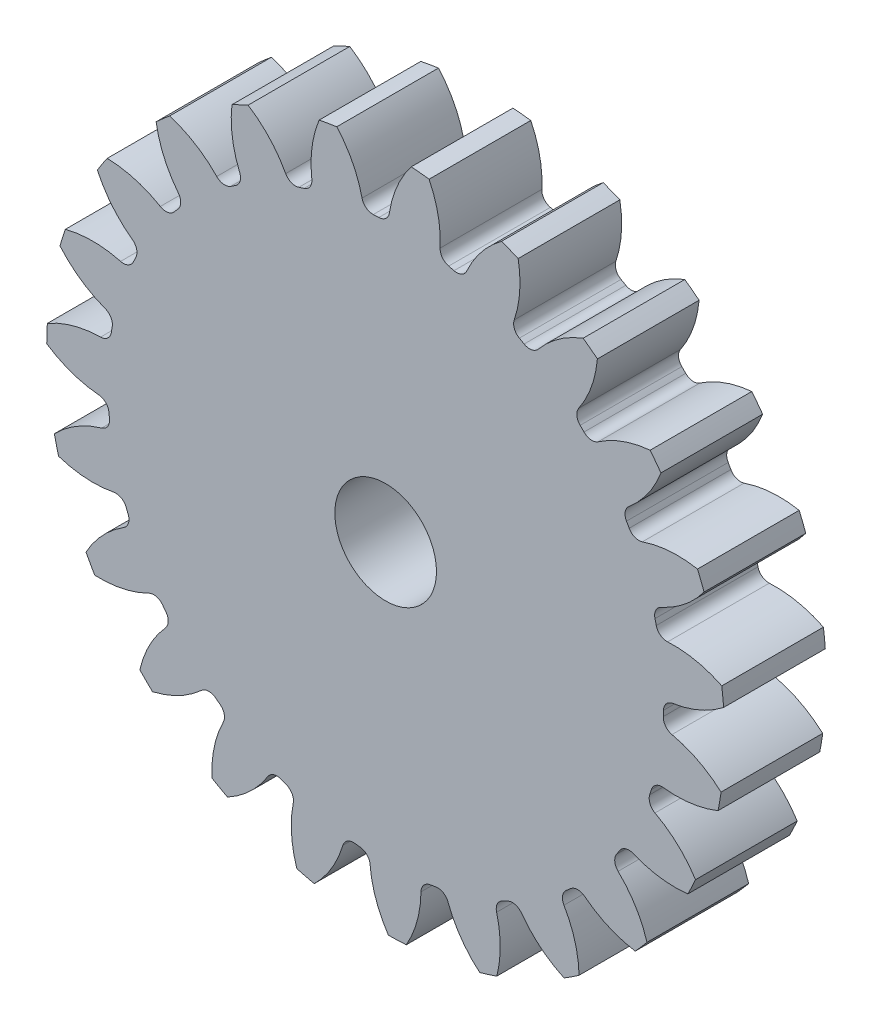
SolidWorks part; units mm, degrees
ref_plane "Front" through (0, 0, 0) normal (0, 0, 1) x (1, 0, 0)
ref_plane "Top" through (0, 0, 0) normal (0, 1, 0) x (1, 0, 0)
ref_plane "Right" through (0, 0, 0) normal (1, 0, 0) x (0, 0, -1)
sketch "Sketch3" plane through (0, 0, 0) normal (0, 0, 1) x (1, 0, 0)
  circle A0 centre (0, 0) radius 423.3333
  dimension "od" = 846.6667
extrude "gearBody" add sketch "Sketch3" along normal blind 127
sketch "Sketch2" plane through (0, 0, 0) normal (0, 0, 1) x (1, 0, 0)
  line L0 (0, 0) -> (338.1205, 140.0541) construction
  line L1 (420.1227, -61.7729) -> (0, 0) construction
  line L2 (0, 0) -> (36.3143, 0) construction
  line L3 (389.237, 13.3729) -> (387.4476, -39.6062) construction
  line L5 (388.3423, -13.1166) -> (0, 0) construction
  line L7 (0, 0) -> (365.979, 0) construction
  arc A0 (365.9246, 6.3083) -> (364.665, -30.9846) centre (0, 0) ccw construction
  arc A1 (422.0985, 32.3104) -> (418.9564, -60.7178) centre (0, 0) ccw construction
  arc A2 (389.237, 13.3729) -> (387.4476, -39.6062) centre (0, 0) ccw construction
  arc A3 (346.8025, -15.1511) -> (347.0345, -8.2839) centre (0, 0) ccw
  arc A4 (420.1227, -61.7729) -> (357.5785, -29.2072) centre (327.8997, -162.5495) ccw
  arc A5 (420.1227, -61.7729) -> (423.3333, 33.2843) centre (0, 0) ccw
  arc A6 (423.3333, 33.2843) -> (358.7343, 5.013) centre (338.1205, 140.0541) cw
  arc A7 (347.0345, -8.2839) -> (358.7343, 5.013) centre (360.8143, -8.6129) cw
  arc A8 (357.5785, -29.2072) -> (346.8025, -15.1511) centre (360.5731, -15.7527) cw
  point P6 (423.3333, 33.2843)
  point P22 (420.1227, -61.7729)
  dimension "baseDia" = 731.9579
  dimension "od" = 846.6667
  dimension "pd" = 778.9333
  dimension "rd" = 694.2667
  dimension "rFillet" = 13.7837
  dimension "pointX" = 423.3333
  dimension "pointY" = 33.2843
  dimension "CTT" = 52.9791
  dimension "flankCenterAngle" = 22.5
extrude "toothCut" cut sketch "Sketch2" along normal through all
pattern_circular "CirPattern1" count 23 over 360 about axis through (0, 0, 0) along (0, 0, 1) of "toothCut"
sketch "hub1Dia" plane through (0, 0, 0) normal (0, 0, -1) x (-1, 0, 0)
  circle A0 centre (0, 0) radius 12.7
  dimension "hub1Dia" = 25.4
sketch "hub2Dia" plane through (0, 0, 127) normal (0, 0, 1) x (1, 0, 0)
  circle A0 centre (0, 0) radius 12.7
  dimension "hub2dia" = 25.4
sketch "boreDia" plane through (0, 0, 0) normal (0, 0, 1) x (1, 0, 0)
  circle A0 centre (0, 0) radius 63.5
  dimension "boreDia" = 127
extrude "bore" cut sketch "boreDia" against normal mid plane 25400
